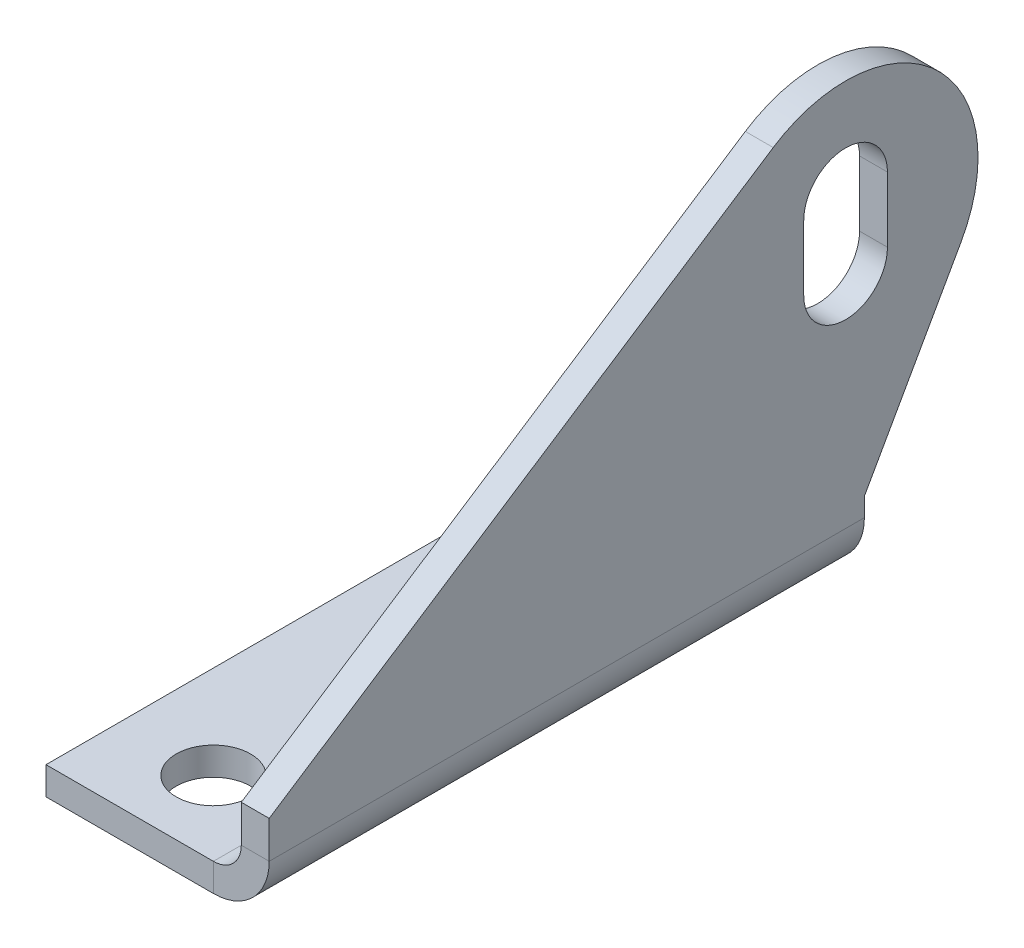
SolidWorks part; units mm, degrees
ref_plane "FRONT" through (0, 0, 0) normal (0, 0, 1) x (1, 0, 0)
ref_plane "TOP" through (0, 0, 0) normal (0, 1, 0) x (1, 0, 0)
ref_plane "RIGHT" through (0, 0, 0) normal (1, 0, 0) x (0, 0, -1)
sketch "Sketch1"
  dimension "D1" = 76.2
  dimension "D2" = 38.1
extrude "Base-Extrude-Thin" add sketch "Sketch1" against normal blind 101.6 thin
sketch "Sketch2"
  dimension "D2" = 76.2
  dimension "D3" = 12.7
  dimension "D4" = 15.875
  dimension "D1" = 12.7
extrude "Cut-Extrude1" cut sketch "Sketch2" against normal through all
sketch "Sketch3"
  dimension "D1" = 38.1
  dimension "D2" = 63.5
extrude "Boss-Extrude1" add sketch "Sketch3" against normal up to surface (4.7625 mm away)
sketch "Sketch4"
  dimension "D1" = 53.0955
  dimension "D3" = 12.7
  dimension "D2" = 98.3923
  dimension "D4" = 25.4
  dimension "D5" = 14.2875
extrude "Cut-Extrude2" cut sketch "Sketch4" against normal through all
sketch "Sketch5"
  dimension "D1" = 22.606
  dimension "D2" = 60.325
extrude "Cut-Extrude3" cut sketch "Sketch5" against normal through all
sheet metal parameters "Sheet-Metal2" parameters "D1"=4.7625
bend "SharpBend2" bend angle 90 parameters "D1"=0, "D5"=1
flatten bends "Flatten-Bends2" parameters "D1"=0
sketch "Sharp-Sketch2"
process bends "Process-Bends2" parameters "D1"=0
sketch "Flat-Sketch2" plane through (-4.7625, 0, 0) normal (-1, 0, 0) x (0, 0, 1)
